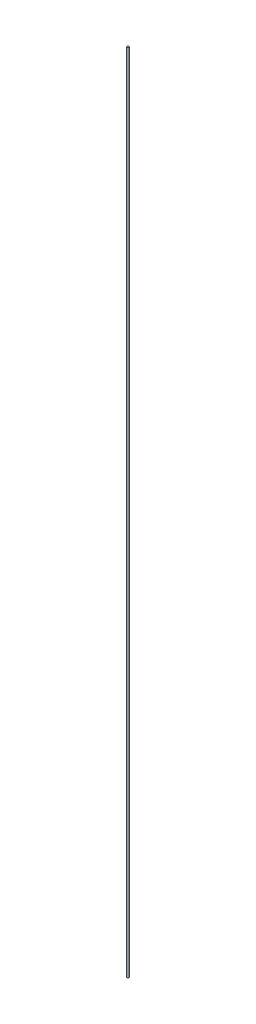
SolidWorks part; units mm, degrees
ref_plane "Alzado" through (0, 0, 0) normal (0, 0, 1) x (1, 0, 0)
ref_plane "Planta" through (0, 0, 0) normal (0, 1, 0) x (1, 0, 0)
ref_plane "Vista lateral" through (0, 0, 0) normal (1, 0, 0) x (0, 0, -1)
sketch "Croquis1" plane through (0, 0, 0) normal (1, 0, 0) x (0, 0, -1)
  line L0 (0, 0) -> (0, 1500)
sketch "Croquis2" plane through (0, 0, 0) normal (0, 1, 0) x (1, 0, 0)
  circle A0 centre (0, 0) radius 2
  dimension "D1" = 4
sweep "Barrer1" add profiles "Croquis2" path "Croquis1"
